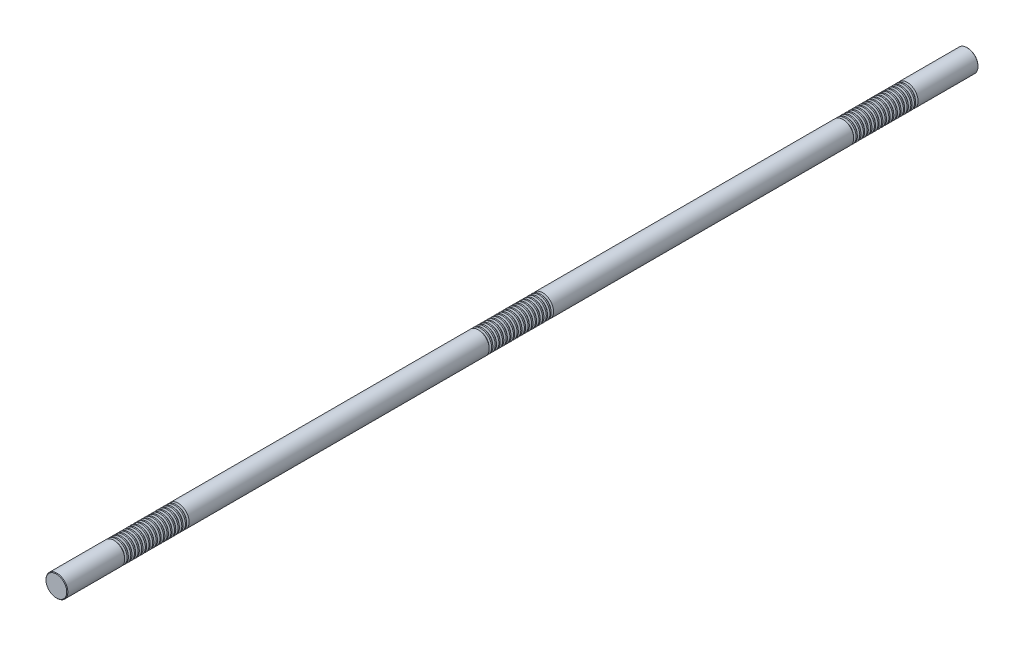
SolidWorks part; units mm, degrees
ref_plane "Front Plane" through (0, 0, 0) normal (0, 0, 1) x (1, 0, 0)
ref_plane "Top Plane" through (0, 0, 0) normal (0, 1, 0) x (1, 0, 0)
ref_plane "Right Plane" through (0, 0, 0) normal (1, 0, 0) x (0, 0, -1)
sketch "Sketch1" plane through (0, 0, 0) normal (0, 0, 1) x (1, 0, 0)
  circle A0 centre (0, 0) radius 18
  dimension "D1" = 36
extrude "Boss-Extrude1" add sketch "Sketch1" along normal mid plane 1500
chamfer "Chamfer1" distance 0.9 angle 45 2 edges at (18, 0, -750) (18, 0, 750)
sketch "Sketch2" plane through (0, 0, 0) normal (1, 0, 0) x (0, 0, -1)
  line L0 (650.4689, 18) -> (646.5311, 18)
  line L1 (749.1, 18) -> (-749.1, 18) construction
  line L2 (646.5311, 18) -> (647.4689, 14.5)
  line L3 (647.4689, 14.5) -> (649.5311, 14.5)
  line L4 (649.5311, 14.5) -> (650.4689, 18)
  line L5 (750, -17.1) -> (750, 17.1) construction
  point P4 (648.5, 18)
  point P7 (648.5, 14.5)
  point P8 (650, 16.25)
  point P9 (647, 16.25)
  dimension "D1" = 3
  dimension "D2" = 100
  dimension "D3" = 3.5
  dimension "D4" = 30
revolve "Cut-Revolve1" cut sketch "Sketch2" angle 360 about axis through (0, 0, 750) along (0, 0, -1)
pattern_linear "LPattern1" count 18 spacing 6 along (0, 0, 1) of "Cut-Revolve1"
pattern_linear "LPattern2" count 3 spacing 600 along (0, 0, 1) of "Cut-Revolve1", "LPattern1"
